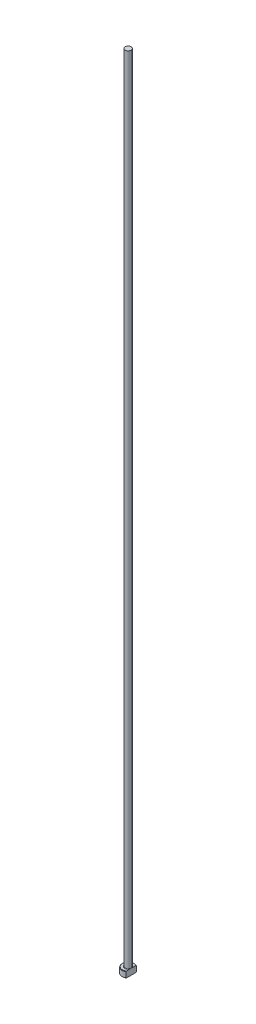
SolidWorks part; units mm, degrees
ref_plane "Front Plane" through (0, 0, 0) normal (0, 0, 1) x (1, 0, 0)
ref_plane "Top Plane" through (0, 0, 0) normal (0, 1, 0) x (1, 0, 0)
ref_plane "Right Plane" through (0, 0, 0) normal (1, 0, 0) x (0, 0, -1)
sketch "Sketch1" plane through (0, 0, 0) normal (0, 0, 1) x (1, 0, 0)
  line L0 (0, 259.9588) -> (0, -15.1925) construction
  line L1 (0, 0) -> (-3, 0)
  line L2 (-3, 0) -> (-3, 3)
  line L3 (-3, 3) -> (-1.5, 3)
  line L4 (-1.5, 3) -> (-1.5, 400)
  line L5 (-1.5, 400) -> (0, 400)
  line L6 (0, 400) -> (0, 0)
  dimension "L" = 400
  dimension "H" = 6
  dimension "T" = 3
  dimension "D" = 3
revolve "Revolve1" add sketch "Sketch1" angle 360 about L0
chamfer "Chamfer1" distance 0.2 angle 45 2 edges at (0, 3, 3) (0, 0, 3)
fillet "Fillet1" radius 0.2 1 edges at (0, 3, 1.5)
sketch "Sketch2" plane through (0, 0, 0) normal (0, 1, 0) x (1, 0, 0)
  line L0 (1.5, 2.5981) -> (1.5, -2.5981)
  circle A0 centre (0, 0) radius 3 construction
  arc A1 (1.5, -2.5981) -> (1.5, 2.5981) centre (0, 0) ccw
  circle A2 centre (0, 0) radius 1.5 construction
extrude "KEY" cut sketch "Sketch2" along normal through all
